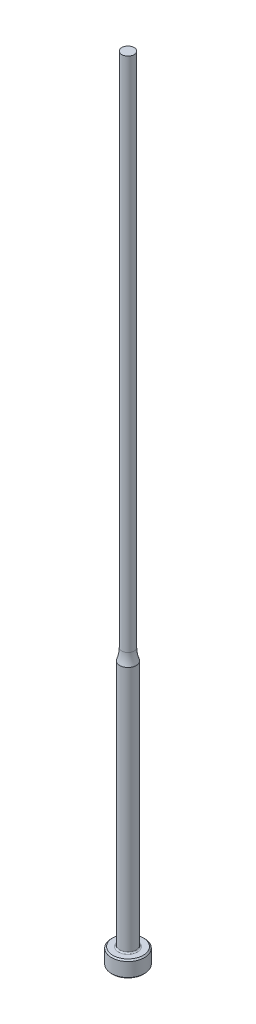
SolidWorks part; units mm, degrees
ref_plane "Front Plane" through (0, 0, 0) normal (0, 0, 1) x (1, 0, 0)
ref_plane "Top Plane" through (0, 0, 0) normal (0, 1, 0) x (1, 0, 0)
ref_plane "Right Plane" through (0, 0, 0) normal (1, 0, 0) x (0, 0, -1)
sketch "Sketch1" plane through (0, 0, 0) normal (0, 0, 1) x (1, 0, 0)
  line L0 (0, 259.9588) -> (0, -15.1925) construction
  line L1 (0, 0) -> (-3.175, 0)
  line L2 (-3.175, 0) -> (-3.175, 3.175)
  line L3 (-3.175, 3.175) -> (-1.5875, 3.175)
  line L4 (-1.19, 53.0114) -> (-1.19, 152.4)
  line L5 (-1.19, 152.4) -> (0, 152.4)
  line L6 (0, 152.4) -> (0, 0)
  line L7 (-1.5875, 3.175) -> (-1.5875, 50.8)
  arc A0 (-1.5875, 50.8) -> (-1.19, 53.0114) centre (-7.54, 53.0114) ccw
  point P13 (-1.5875, 0)
  dimension "D1" = 6.35
  dimension "L" = 152.4
  dimension "D2" = 3.175
  dimension "H" = 6.35
  dimension "T" = 3.175
  dimension "D" = 2.38
  dimension "S" = 50.8
revolve "Revolve1" add sketch "Sketch1" angle 360 about L0
chamfer "Chamfer1" distance 0.254 angle 45 2 edges at (0, 3.175, 3.175) (0, 0, 3.175)
fillet "Fillet1" radius 0.254 1 edges at (0, 3.175, 1.5875)
